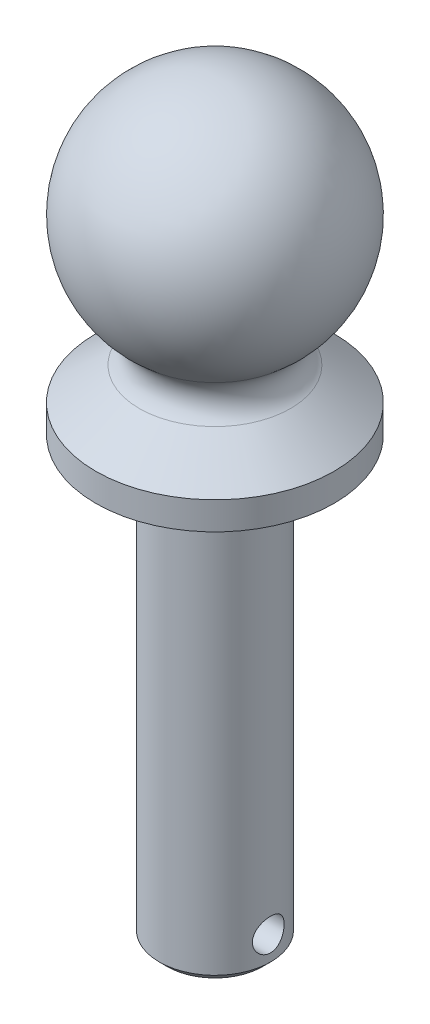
SolidWorks part; units mm, degrees
ref_plane "Plan1" through (0, 0, 0) normal (0, 0, 1) x (1, 0, 0)
ref_plane "Plan2" through (0, 0, 0) normal (0, 1, 0) x (1, 0, 0)
ref_plane "Plan3" through (0, 0, 0) normal (1, 0, 0) x (0, 0, -1)
sketch "Esquisse1" plane through (0, 0, 0) normal (0, 0, 1) x (1, 0, 0)
  line L0 (0, 15) -> (0, -79)
  line L1 (0, -79) -> (-6, -79)
  line L2 (-6, -79) -> (-7, -78)
  line L3 (-7, -78) -> (-7, -24)
  line L4 (-7, -24) -> (-15, -24)
  line L5 (-15, -24) -> (-15, -20.5)
  line L6 (-15, -20.5) -> (-9.5237, -16.3914)
  line L7 (0, -80) -> (0, -87) construction
  arc A0 (0, 15) -> (-9.4367, -11.6597) centre (0, 0) ccw
  arc A1 (-9.5237, -16.3914) -> (-9.4367, -11.6597) centre (-11.324, -13.9916) ccw
  dimension "D1" = 3
revolve "Base-Révolution" add sketch "Esquisse1" angle 360 about L7
sketch "Esquisse2" plane through (0, 0, 0) normal (1, 0, 0) x (0, 0, -1)
  line L0 (-6, -79) -> (6, -79) construction
  circle A0 centre (0, -75) radius 2
  dimension "D1" = 4
extrude "Enlèv. mat.-Extru.1" cut sketch "Esquisse2" against normal through all and the other way through all
